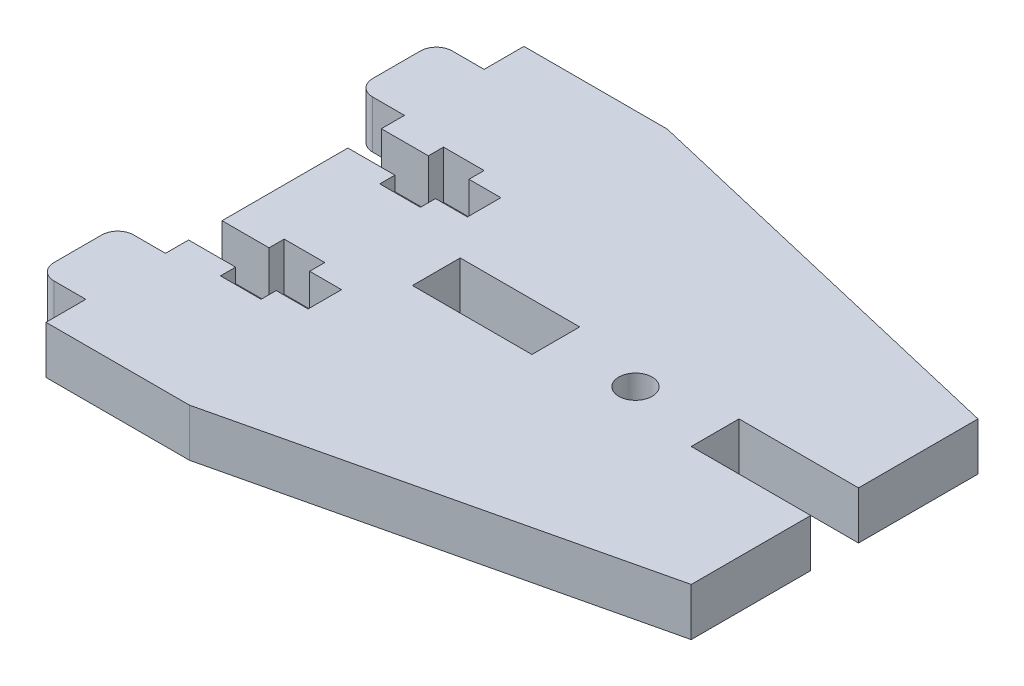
SolidWorks part; units mm, degrees
ref_plane "Спереди" through (0, 0, 0) normal (0, 0, 1) x (1, 0, 0)
ref_plane "Сверху" through (0, 0, 0) normal (0, 1, 0) x (1, 0, 0)
ref_plane "Справа" through (0, 0, 0) normal (1, 0, 0) x (0, 0, -1)
sketch "Эскиз1" plane through (0, 0, 0) normal (0, 1, 0) x (1, 0, 0)
  line L0 (18, 60) -> (69, 48)
  line L1 (0, 0) -> (69, 0)
  line L2 (0, 0) -> (0, 60)
  line L3 (0, 60) -> (69, 60)
  line L4 (69, 0) -> (69, 60)
  line L5 (69, 33) -> (54, 33)
  line L6 (69, 33) -> (69, 27)
  line L7 (69, 27) -> (54, 27)
  line L8 (54, 33) -> (54, 27)
  line L9 (34, 33) -> (19, 33)
  line L10 (34, 33) -> (34, 27)
  line L11 (34, 27) -> (19, 27)
  line L12 (19, 33) -> (19, 27)
  line L13 (0, 55) -> (-4, 55)
  line L14 (0, 55) -> (0, 45)
  line L15 (0, 45) -> (-4, 45)
  line L16 (-6, 53) -> (-6, 47)
  line L17 (0, 15) -> (-4, 15)
  line L18 (0, 15) -> (0, 5)
  line L19 (0, 5) -> (-4, 5)
  line L20 (-6, 13) -> (-6, 7)
  line L21 (0, 42.1) -> (15, 42.1)
  line L22 (0, 42.1) -> (0, 37.9)
  line L23 (0, 37.9) -> (15, 37.9)
  line L24 (15, 42.1) -> (15, 37.9)
  line L25 (11, 44) -> (5.9, 44)
  line L26 (11, 44) -> (11, 36)
  line L27 (11, 36) -> (5.9, 36)
  line L28 (5.9, 44) -> (5.9, 36)
  line L29 (0, 22.1) -> (15, 22.1)
  line L30 (0, 22.1) -> (0, 17.9)
  line L31 (0, 17.9) -> (15, 17.9)
  line L32 (15, 22.1) -> (15, 17.9)
  line L33 (5.9, 24) -> (11, 24)
  line L34 (5.9, 24) -> (5.9, 16)
  line L35 (5.9, 16) -> (11, 16)
  line L36 (11, 24) -> (11, 16)
  line L37 (18, 0) -> (69, 12)
  circle A0 centre (44, 30) radius 2.1
  arc A1 (-4, 5) -> (-6, 7) centre (-4, 7) cw
  arc A2 (-4, 15) -> (-6, 13) centre (-4, 13) ccw
  arc A3 (-4, 45) -> (-6, 47) centre (-4, 47) cw
  arc A4 (-4, 55) -> (-6, 53) centre (-4, 53) ccw
  point P14 (34, 30)
  point P15 (54, 30)
  point P18 (0, 30)
  point P43 (15, 40)
  point P44 (11, 40)
  point P45 (15, 20)
  point P46 (11, 20)
  point P48 (-6, 5)
  point P51 (-6, 15)
  point P54 (-6, 45)
  point P57 (-6, 55)
  point P58 (69, 12)
  point P59 (69, 48)
  point P60 (18, 0)
  point P61 (18, 60)
extrude "Бобышка-Вытянуть1" add sketch "Эскиз1" along normal blind 6 contours L17 A2 L20 A1 L19 L2 | L13 A4 L16 A3 L15 L2 | L1 L37 L4 L7 L8 L5 L0 L3 L2 L21 L28 L25 L26 L24 L23 L27 L29 L34 L33 L36 L32 L31 L35 A0 L12 L9 L10 L11
equation "\"D9@Эскиз1\"=\"D7@Эскиз1\"/2"
